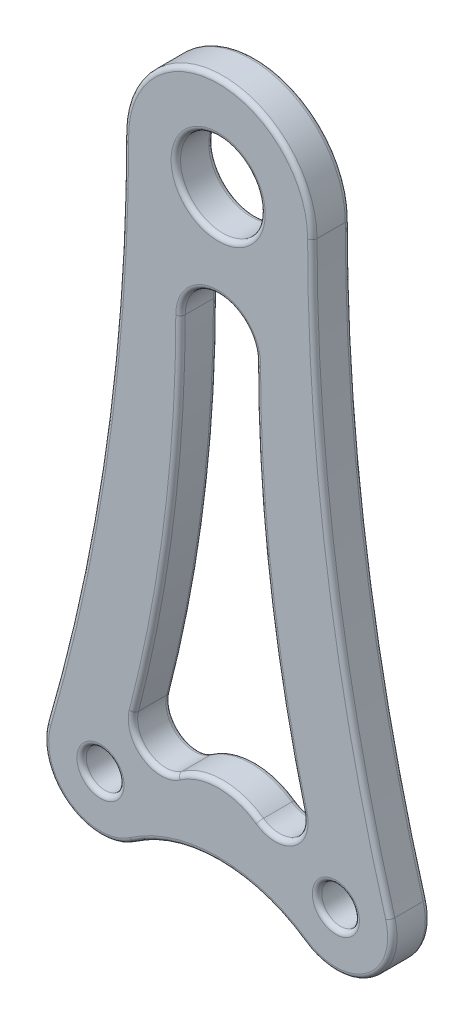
SolidWorks part; units mm, degrees
ref_plane "Спереди" through (0, 0, 0) normal (0, 0, 1) x (1, 0, 0)
ref_plane "Сверху" through (0, 0, 0) normal (0, 1, 0) x (1, 0, 0)
ref_plane "Справа" through (0, 0, 0) normal (1, 0, 0) x (0, 0, -1)
sketch "Эскиз1" plane through (0, 0, 0) normal (0, 0, 1) x (1, 0, 0)
  line L0 (0, -14) -> (0, -60) construction
  line L1 (-10, 0) -> (-10, 28.6215) construction
  line L2 (-4, -14) -> (-4, -7.5469) construction
  circle A0 centre (0, 0) radius 4.5
  arc A1 (10, 0) -> (-10, 0) centre (0, 0) ccw
  arc A2 (4, -14) -> (-4, -14) centre (0, -14) ccw
  circle A3 centre (-12.5, -60) radius 2
  circle A4 centre (12.5, -60) radius 2
  arc A5 (-8.9545, -52.9489) -> (-4.3214, -56.1519) centre (-6.05, -53.7) ccw
  arc A6 (8.9545, -52.9489) -> (4.3214, -56.1519) centre (6.05, -53.7) cw
  arc A7 (-18.2639, -58.3334) -> (-9.0909, -64.9374) centre (-12.5, -60) ccw
  arc A8 (18.2639, -58.3334) -> (9.0909, -64.9374) centre (12.5, -60) cw
  arc A9 (9.0909, -64.9374) -> (-9.0909, -64.9374) centre (0, -78.1039) ccw
  arc A10 (-18.2639, -58.3334) -> (-10, 0) centre (-220.0147, 0) ccw
  arc A11 (18.2639, -58.3334) -> (10, 0) centre (220.0147, 0) cw
  arc A12 (4.3214, -56.1519) -> (-4.3214, -56.1519) centre (0, -62.2818) ccw
  arc A13 (-8.9545, -52.9489) -> (-4, -14) centre (-159.5735, -14) ccw
  arc A14 (8.9545, -52.9489) -> (4, -14) centre (159.5735, -14) cw
  dimension "D1" = 9
  dimension "D2" = 20
  dimension "D3" = 8
  dimension "D6" = 4
  dimension "D8" = 6
  dimension "D11" = 12
  dimension "D12" = 32
  dimension "D13" = 15
  dimension "D4" = 14
  dimension "D5" = 25
  dimension "D7" = 60
  dimension "D9" = 12.1
  dimension "D10" = 6.3
extrude "Бобышка-Вытянуть1" add sketch "Эскиз1" along normal mid plane 4
fillet "Скругление1" radius 0.5 30 edges at (10.5, -60, -2) (-7.756, -56.1677, -2) (-5.2436, -33.6314, -2) (0, -10, -2) (5.2436, -33.6314, -2) (7.756, -56.1677, -2) (0, -54.7818, -2) (16.0056, -64.8694, -2) (12.0762, -29.4579, -2) (0, 10, -2) (-12.0762, -29.4579, -2) (-16.0056, -64.8694, -2) (0, -62.1039, -2) (4.5, 0, -2) (-10.5, -60, -2) (10.5, -60, 2) (5.2436, -33.6314, 2) (0, -10, 2) (-5.2436, -33.6314, 2) (-7.756, -56.1677, 2) (0, -54.7818, 2) (7.756, -56.1677, 2) (-16.0056, -64.8694, 2) (-12.0762, -29.4579, 2) (0, 10, 2) (12.0762, -29.4579, 2) (16.0056, -64.8694, 2) (0, -62.1039, 2) (4.5, 0, 2) (-10.5, -60, 2)
